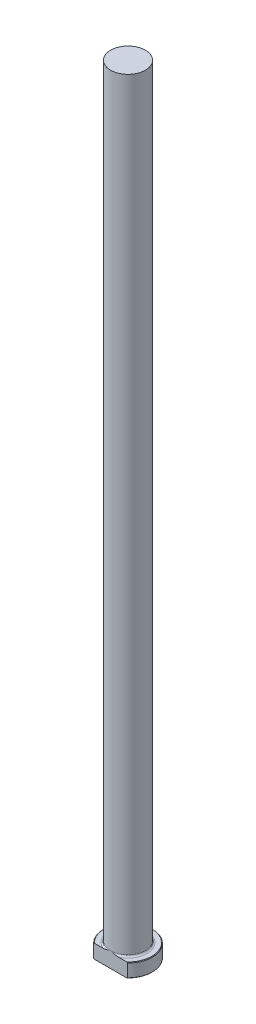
SolidWorks part; units mm, degrees
ref_plane "Front Plane" through (0, 0, 0) normal (0, 0, 1) x (1, 0, 0)
ref_plane "Top Plane" through (0, 0, 0) normal (0, 1, 0) x (1, 0, 0)
ref_plane "Right Plane" through (0, 0, 0) normal (1, 0, 0) x (0, 0, -1)
sketch "Sketch1" plane through (0, 0, 0) normal (0, 0, 1) x (1, 0, 0)
  line L0 (0, 259.9588) -> (0, -15.1925) construction
  line L1 (0, 0) -> (-11.1125, 0)
  line L2 (-11.1125, 0) -> (-11.1125, 6.35)
  line L3 (-11.1125, 6.35) -> (-7.9375, 6.35)
  line L4 (-7.9375, 6.35) -> (-7.9375, 355.6)
  line L5 (-7.9375, 355.6) -> (0, 355.6)
  line L6 (0, 355.6) -> (0, 0)
  dimension "L" = 355.6
  dimension "H" = 22.225
  dimension "T" = 6.35
  dimension "D" = 15.875
revolve "Revolve1" add sketch "Sketch1" angle 360 about L0
chamfer "Chamfer1" distance 0.254 angle 45 2 edges at (0, 6.35, 11.1125) (0, 0, 11.1125)
fillet "Fillet1" radius 0.762 1 edges at (0, 6.35, 7.9375)
sketch "Sketch2" plane through (0, 0, 0) normal (0, -1, 0) x (1, 0, 0)
  line L0 (-7.7771, 7.9375) -> (7.7771, 7.9375)
  arc A0 (7.7771, 7.9375) -> (-7.7771, 7.9375) centre (0, 0) ccw
  circle A1 centre (0, 0) radius 11.1125 construction
  circle A3 centre (0, 0) radius 7.9375 construction
extrude "KEY" cut sketch "Sketch2" against normal through all
sketch "Pocket Sketch" plane through (0, 0, 0) normal (0, 0, 1) x (1, 0, 0)
  line L0 (-11.5094, 0) -> (-11.5094, 6.3754)
  line L1 (-11.5094, 6.3754) -> (-9.0964, 6.3754)
  line L2 (-8.3344, 7.1374) -> (-8.3344, 22.225)
  line L3 (-8.3344, 22.225) -> (0, 22.225)
  line L4 (0, 22.225) -> (0, 0)
  line L5 (0, 0) -> (-11.5094, 0)
  line L6 (0, 12.6104) -> (0, -2.4989) construction
  line L7 (-11.1125, 6.096) -> (-11.1125, 0.254) construction
  line L8 (10.8585, 6.35) -> (-10.8585, 6.35) construction
  line L9 (-7.9375, 355.6) -> (-7.9375, 7.112) construction
  line L10 (-9.0964, 6.3754) -> (-8.3344, 7.1374)
  point P3 (-8.3344, 6.3754)
  dimension "D1" = 23.0187
  dimension "D2" = 0.3969
  dimension "D3" = 0.0254
  dimension "D4" = 0.3969
  dimension "D5" = 16.6687
  dimension "D6" = 22.225
